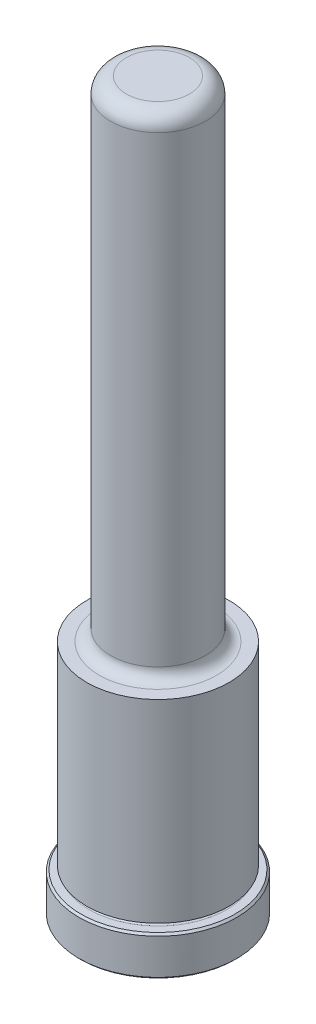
SolidWorks part; units mm, degrees
ref_plane "Front Plane" through (0, 0, 0) normal (0, 0, 1) x (1, 0, 0)
ref_plane "Top Plane" through (0, 0, 0) normal (0, 1, 0) x (1, 0, 0)
ref_plane "Right Plane" through (0, 0, 0) normal (1, 0, 0) x (0, 0, -1)
sketch "Sketch1" plane through (0, 0, 0) normal (1, 0, 0) x (0, 0, -1)
  line L0 (0, 0) -> (15.875, 0)
  line L1 (15.875, 0) -> (15.875, 7.9248)
  line L2 (15.875, 7.9248) -> (13.8938, 7.9248)
  line L3 (13.5128, 2.6782) -> (13.5128, 5.9795) construction
  line L4 (13.8938, 8.6868) -> (14.3002, 8.6868)
  line L5 (14.3002, 8.6868) -> (14.3002, 47.625)
  line L6 (14.3002, 47.625) -> (11.7983, 47.625)
  line L7 (9.5123, 49.911) -> (9.5123, 146.05)
  line L9 (9.5123, 146.05) -> (0, 146.05)
  line L10 (0, 146.05) -> (0, 0)
  line L11 (0, 0) -> (0, -7.2694) construction
  arc A0 (13.8938, 8.6868) -> (13.8938, 7.9248) centre (13.8938, 8.3058) ccw
  arc A1 (11.7983, 47.625) -> (9.5123, 49.911) centre (11.7983, 49.911) cw
  point P2 (9.5123, 146.05)
  point P14 (9.5123, 145.8438)
  point P19 (9.5123, 47.625)
  dimension "D14" = 0.762
  dimension "D8" = 2.286
  dimension "T" = 7.9248
  dimension "D2" = 0.762
  dimension "M" = 31.75
  dimension "B" = 28.6004
  dimension "L" = 146.05
  dimension "D7" = 0.7874
  dimension "A" = 47.625
  dimension "D" = 19.0246
  dimension "D15" = 98.425
revolve "Revolve1" add sketch "Sketch1" angle 360 about L11
chamfer "Chamfer1" distance 0.381 angle 45 2 edges at (0, 0, 15.875) (0, 7.9248, 15.875)
fillet "Fillet1" radius 3.175 1 edges at (0, 146.05, 9.5123)
